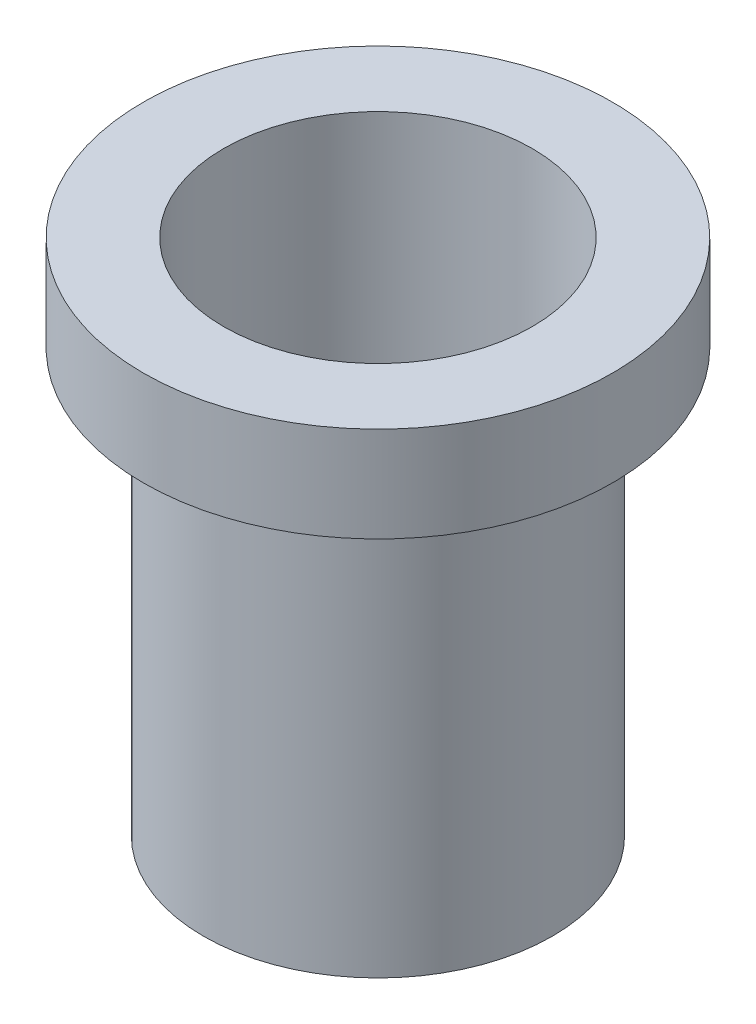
SolidWorks part; units mm, degrees
ref_plane "Front Plane" through (0, 0, 0) normal (0, 0, 1) x (1, 0, 0)
ref_plane "Top Plane" through (0, 0, 0) normal (0, 1, 0) x (1, 0, 0)
ref_plane "Right Plane" through (0, 0, 0) normal (1, 0, 0) x (0, 0, -1)
sketch "Sketch2" plane through (0, 0, 0) normal (0, 0, 1) x (1, 0, 0)
  line L0 (0, 11.5156) -> (0, -46.9432) construction
  line L1 (46.355, 0) -> (70.485, 0)
  line L2 (46.355, 0) -> (46.355, -155.575)
  line L3 (46.355, -155.575) -> (52.3875, -155.575)
  line L4 (52.3875, -28.575) -> (52.3875, -155.575)
  line L7 (52.3875, -28.575) -> (70.485, -28.575)
  line L8 (70.485, 0) -> (70.485, -28.575)
  dimension "D1" = 70.485
  dimension "D2" = 52.3875
  dimension "D3" = 46.355
  dimension "D4" = 28.575
  dimension "D5" = 155.575
revolve "Revolve1" add sketch "Sketch2" angle 360 about L0
